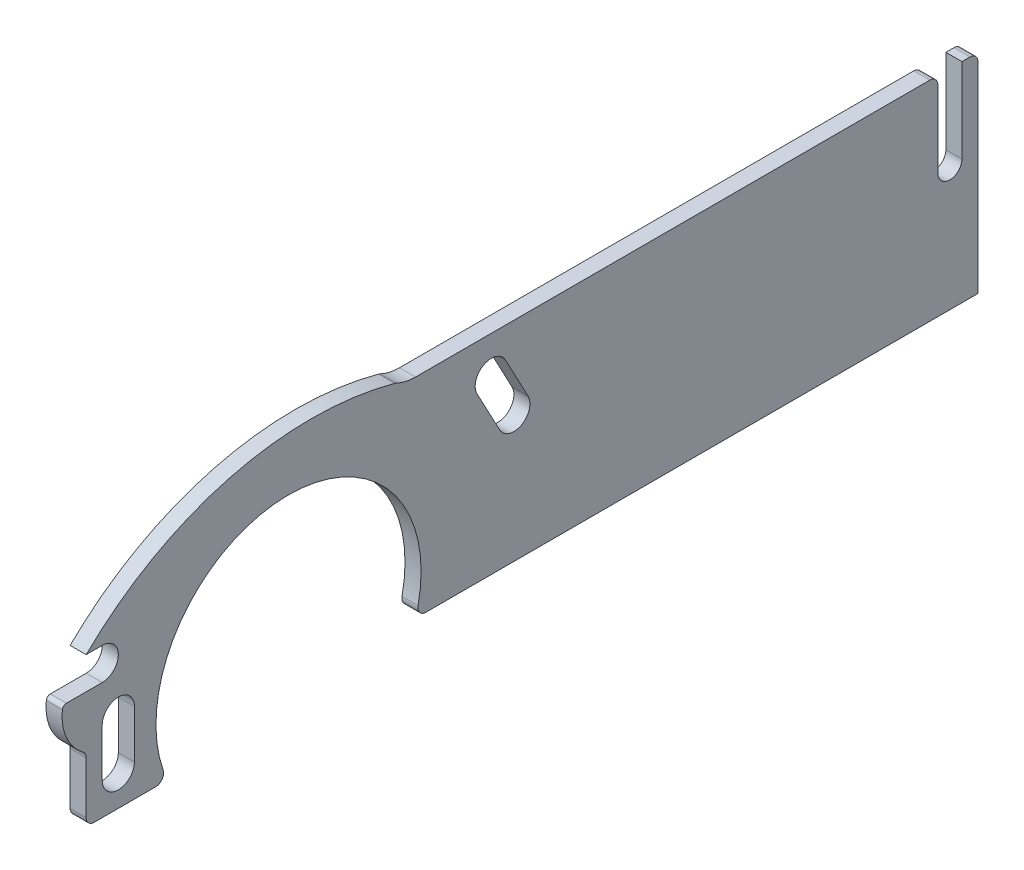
SolidWorks part; units mm, degrees
ref_plane "Plano frontal" through (0, 0, 0) normal (0, 0, 1) x (1, 0, 0)
ref_plane "Plano superior" through (0, 0, 0) normal (0, 1, 0) x (1, 0, 0)
ref_plane "Plano direito" through (0, 0, 0) normal (1, 0, 0) x (0, 0, -1)
sketch "Esboço1" plane through (0, 0, 0) normal (1, 0, 0) x (0, 0, -1)
  line L0 (0, 0) -> (0, 25)
  line L1 (-1, 26) -> (-2, 26)
  line L2 (0, 0) -> (-68.7116, 0)
  line L4 (-111, 16.5714) -> (-109, 16.5714)
  line L5 (-113.4662, 12.5714) -> (-109, 12.5714)
  line L6 (-111, 5.4739) -> (-111, -1)
  line L7 (-110, -2) -> (-102.3584, -2)
  line L8 (-107, 8) -> (-107, 2) construction
  line L9 (-105, 8) -> (-105, 2)
  line L10 (-109, 8) -> (-109, 2)
  line L11 (-60.5827, 21.2977) -> (-57.7659, 16) construction
  line L12 (-58.8168, 22.2366) -> (-56, 16.9389)
  line L13 (-62.3486, 20.3587) -> (-59.5318, 15.0611)
  line L14 (-73.5187, 0) -> (-73.5187, 40.5695) construction
  line L15 (-3.5, 25.5) -> (-3.5, 15.5) construction
  line L16 (-2, 26) -> (-2, 15.5)
  line L17 (-5, 25) -> (-5, 15.5)
  line L18 (-6, 26) -> (-70, 26)
  arc A0 (-70, 26) -> (-72.434, 26.5573) centre (-70, 31.5939) cw
  arc A1 (-72.6089, 26.6225) -> (-111, 16.5714) centre (-83.0134, -11.9814) ccw
  arc A2 (-113.9634, 12.1247) -> (-113.4662, 12.5714) centre (-113.4662, 12.0714) cw
  arc A3 (-109, 12.5714) -> (-109, 16.5714) centre (-109, 14.5714) ccw
  arc A4 (-113.9634, 12.1247) -> (-111.4037, 6.2767) centre (-107.5692, 11.4392) ccw
  arc A5 (-69.6889, 1.2118) -> (-101.413, -0.674) centre (-85.8147, 4.7059) ccw
  arc A6 (-105, 8) -> (-109, 8) centre (-107, 8) ccw
  arc A7 (-109, 2) -> (-105, 2) centre (-107, 2) ccw
  arc A8 (-58.8168, 22.2366) -> (-62.3486, 20.3587) centre (-60.5827, 21.2977) ccw
  arc A9 (-59.5318, 15.0611) -> (-56, 16.9389) centre (-57.7659, 16) ccw
  arc A10 (-72.434, 26.5573) -> (-72.6089, 26.6225) centre (-72.8691, 25.6569) ccw
  arc A11 (-5, 15.5) -> (-2, 15.5) centre (-3.5, 15.5) ccw
  arc A12 (-5, 25) -> (-6, 26) centre (-6, 25) ccw
  arc A14 (0, 25) -> (-1, 26) centre (-1, 25) ccw
  arc A15 (-68.7116, 0) -> (-69.6889, 1.2118) centre (-68.7116, 1) cw
  arc A16 (-102.3584, -2) -> (-101.413, -0.674) centre (-102.3584, -1) ccw
  arc A17 (-111.4037, 6.2767) -> (-111, 5.4739) centre (-112, 5.4739) cw
  arc A18 (-111, -1) -> (-110, -2) centre (-110, -1) ccw
  point P11 (-131.5694, 15.2283)
  point P25 (-107, 5)
  point P32 (-59.1743, 18.6488)
  point P41 (-7, 21)
  point P54 (-70, 0)
  point P57 (-100.8906, -2)
  point P60 (-111, 6)
  point P63 (-111, -2)
  dimension "D10" = 33
  dimension "D14" = 10
  dimension "D17" = 10
  dimension "D24" = 0.5
  dimension "D25" = 1
  dimension "D26" = 1
  dimension "D1" = 26
  dimension "D2" = 70
  dimension "D3" = 114
  dimension "D4" = 4
  dimension "D6" = 2
  dimension "D7" = 111
  dimension "D8" = 8
  dimension "D9" = 28
  dimension "D11" = 4
  dimension "D12" = 4
  dimension "D13" = 2
  dimension "D15" = 28
  dimension "D16" = 4
  dimension "D18" = 56
  dimension "D19" = 14
  dimension "D20" = 3
  dimension "D21" = 2
  dimension "D22" = 12
  dimension "D23" = 2
extrude "Ressalto-extrusão1" add sketch "Esboço1" along normal blind 2
